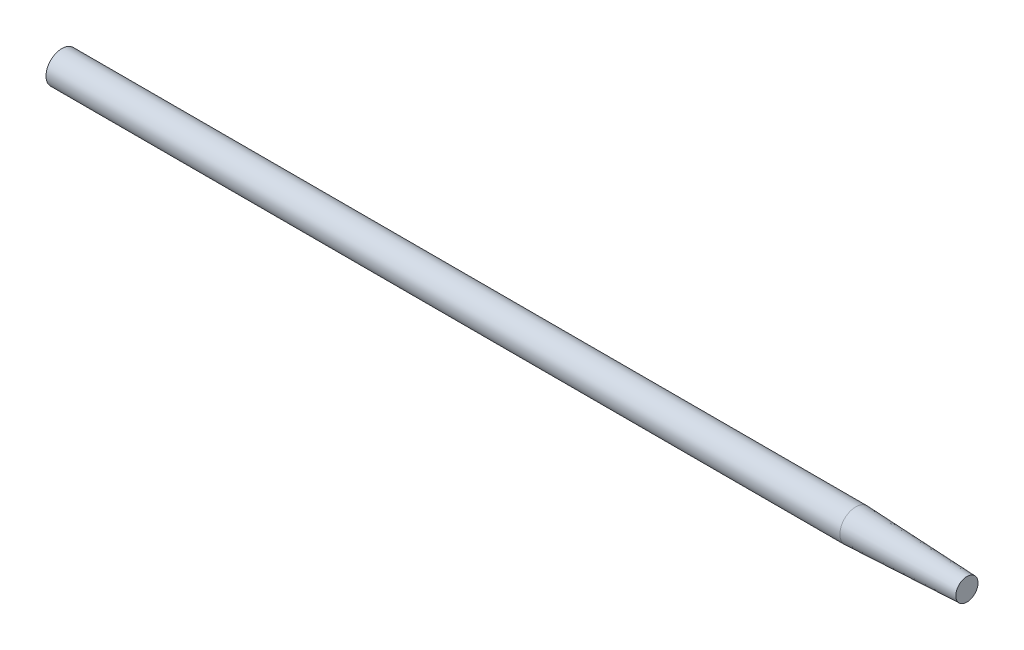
SolidWorks part; units mm, degrees
ref_plane "Ön Düzlem" through (0, 0, 0) normal (0, 0, 1) x (1, 0, 0)
ref_plane "Üst Düzlem" through (0, 0, 0) normal (0, 1, 0) x (1, 0, 0)
ref_plane "Sağ Düzlem" through (0, 0, 0) normal (1, 0, 0) x (0, 0, -1)
sketch "Çizim1" plane through (0, 0, 0) normal (0, 0, 1) x (1, 0, 0)
  line L1 (0, 0) -> (570, 0)
  line L2 (0, 0) -> (0, 10)
  line L3 (0, 10) -> (570, 10)
  line L4 (570, 0) -> (570, 10)
  dimension "D1" = 10
  dimension "D2" = 570
revolve "Döndür1" add sketch "Çizim1" angle 360 about L1
chamfer "Pah1" distance 3 distance2 70 1 edges at (570, 0, 10)
